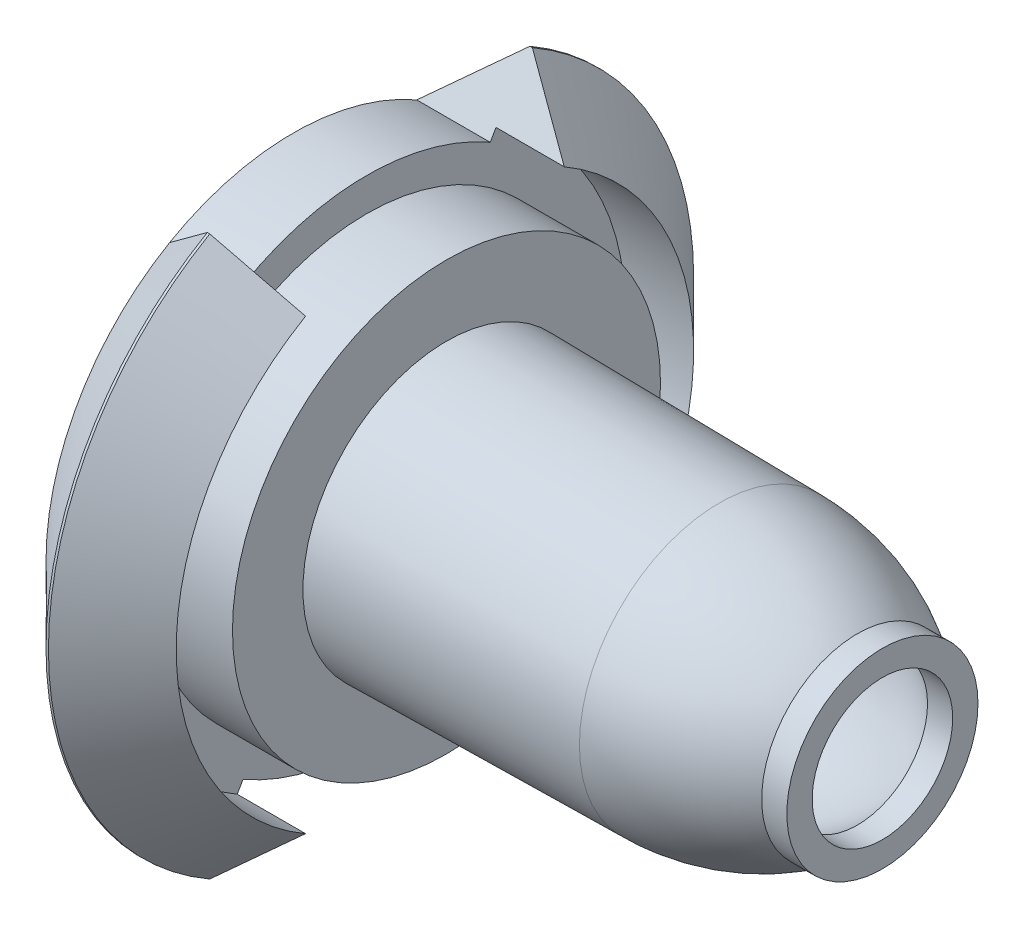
SolidWorks part; units mm, degrees
ref_plane "Front Plane" through (0, 0, 0) normal (0, 0, 1) x (1, 0, 0)
ref_plane "Top Plane" through (0, 0, 0) normal (0, 1, 0) x (1, 0, 0)
ref_plane "Right Plane" through (0, 0, 0) normal (1, 0, 0) x (0, 0, -1)
sketch "Sketch1" plane through (0, 0, 0) normal (0, 1, 0) x (1, 0, 0)
  line L0 (-1, 2.3995) -> (0, 2.3995)
  line L1 (0, 2.3995) -> (0, 1.3931)
  line L2 (0, 1.3931) -> (-1, 1.3931)
  line L3 (-6.4864, 4.1592) -> (-6.4864, 3.2326)
  line L4 (0, -1.4009) -> (-7.7416, -1.4009) construction
  arc A0 (-1, 2.3995) -> (-6.4864, 4.1592) centre (-6.5058, -5.334) ccw
  arc A1 (-1, 1.3931) -> (-6.4864, 3.2326) centre (-6.6446, -6.3408) ccw
  dimension "D1" = 2.794
revolve "Revolve1" add sketch "Sketch1" angle 360 about L4
sketch "Sketch2" plane through (0, 0, 0) normal (0, 1, 0) x (1, 0, 0)
  line L0 (8.3218, -1.4009) -> (-17.1874, -1.4009) construction
  line L1 (-6.4864, 4.1592) -> (-17.3322, 4.3069)
  line L2 (-23.4282, 3.4633) -> (-6.4864, 3.2326) construction
  line L3 (-20.2532, 8.6321) -> (-20.2532, -11.4339) construction
  line L4 (-23.4282, 4.2614) -> (-23.4282, 3.5903)
  line L5 (-6.4864, 3.3596) -> (-6.4864, 4.1592)
  line L6 (-17.3322, 7.1081) -> (-20.5072, 7.1081)
  line L7 (-20.5072, 7.1081) -> (-20.5072, 8.8861)
  line L8 (-6.4864, 3.2346) -> (-31.8864, 3.5775) construction
  line L9 (-17.3322, 7.3621) -> (-20.2532, 7.3621) construction
  line L10 (5.1468, 7.3621) -> (-20.2532, 7.3621) construction
  line L11 (-20.2532, 7.3621) -> (-20.2532, 8.6321) construction
  line L12 (-20.2532, 8.6321) -> (-17.3322, 8.6321) construction
  line L13 (5.1468, 8.6321) -> (-20.2532, 8.6321) construction
  line L14 (-20.5072, 8.8861) -> (-17.3322, 8.8861)
  line L15 (-17.3322, 8.8861) -> (-17.3322, 11.4261)
  line L16 (-17.3322, 11.4261) -> (-23.4282, 11.4261)
  line L17 (-23.4282, 11.4261) -> (-23.4282, 4.2614)
  line L18 (-17.3322, 7.1081) -> (-17.3322, 4.3069)
  line L19 (-6.4864, 3.3596) -> (-23.4282, 3.5903)
  line L20 (-23.4282, 3.5903) -> (-23.4282, 3.4633) construction
  dimension "D1" = 3.175
  dimension "D2" = 0.254
  dimension "D3" = 2.54
  dimension "D4" = 3.175
  dimension "D5" = 0.127
revolve "Revolve3" add sketch "Sketch2" angle 360 about L0
chamfer "Chamfer1" distance 3 angle 45 2 edges at (-17.3322, 0, -11.4261) (-23.4282, 0, -11.4261)
sketch "Sketch4" plane through (-23.4282, 0, 0) normal (-1, 0, 0) x (0, 0, 1)
  line L0 (-3.5126, 8.5104) -> (-5.0126, 11.1085)
  line L1 (6.3144, 8.5104) -> (7.8144, 11.1085)
  line L2 (1.4009, 9.827) -> (1.4009, 12.827) construction
  line L3 (1.4009, 0) -> (23.3691, 0) construction
  line L4 (-3.5126, -8.5104) -> (-5.0126, -11.1085)
  line L5 (6.3144, -8.5104) -> (7.8144, -11.1085)
  line L6 (1.4009, 9.827) -> (1.4009, 0) construction
  line L7 (6.3144, 8.5104) -> (1.4009, 0) construction
  arc A0 (-3.5126, -8.5104) -> (6.3144, -8.5104) centre (1.4009, 0) ccw
  circle A1 centre (1.4009, 0) radius 9.827 construction
  arc A2 (-5.0126, -11.1085) -> (7.8144, -11.1085) centre (1.4009, 0) ccw
  circle A3 centre (1.4009, 0) radius 12.827 construction
  arc A4 (7.8144, 11.1085) -> (-5.0126, 11.1085) centre (1.4009, 0) ccw
  arc A5 (6.3144, 8.5104) -> (-3.5126, 8.5104) centre (1.4009, 0) ccw
  dimension "D1" = 30
  dimension "D2" = 30
extrude "Cut-Extrude1" cut sketch "Sketch4" against normal blind 10
